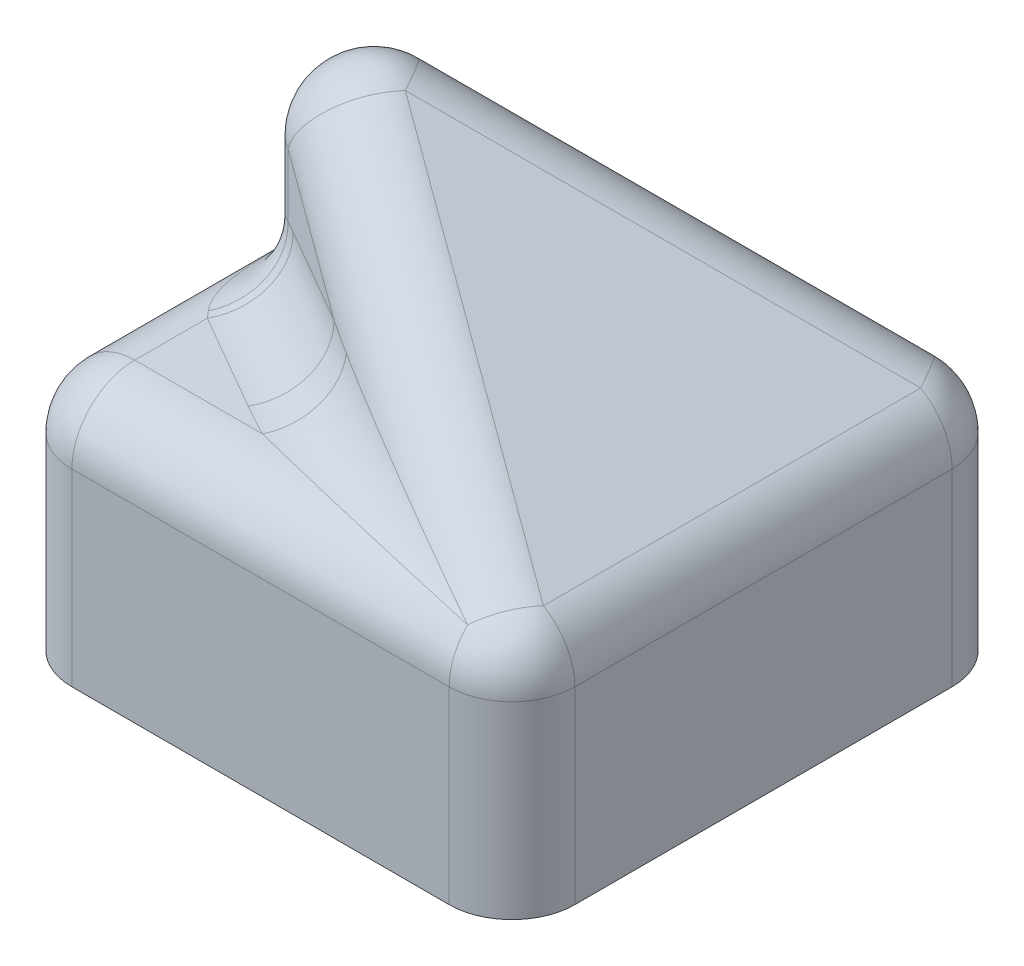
SolidWorks part; units mm, degrees
ref_plane "Front" through (0, 0, 0) normal (0, 0, 1) x (1, 0, 0)
ref_plane "Top" through (0, 0, 0) normal (0, 1, 0) x (1, 0, 0)
ref_plane "Right" through (0, 0, 0) normal (1, 0, 0) x (0, 0, -1)
sketch "Sketch1" plane through (0, 0, 0) normal (0, 1, 0) x (1, 0, 0)
  line L0 (-25.4, -25.4) -> (25.4, 25.4) construction
  line L1 (-19.05, -25.4) -> (19.05, -25.4)
  line L2 (-25.4, -19.05) -> (-25.4, 19.05)
  line L3 (-19.05, 25.4) -> (19.05, 25.4)
  line L4 (25.4, -19.05) -> (25.4, 19.05)
  arc A0 (-25.4, 19.05) -> (-19.05, 25.4) centre (-19.05, 19.05) cw
  arc A1 (-19.05, -25.4) -> (-25.4, -19.05) centre (-19.05, -19.05) cw
  arc A2 (19.05, -25.4) -> (25.4, -19.05) centre (19.05, -19.05) ccw
  arc A3 (19.05, 25.4) -> (25.4, 19.05) centre (19.05, 19.05) cw
  point P11 (25.4, -25.4)
  dimension "D2" = 6.35
  dimension "D1" = 50.8
extrude "Bottom Piece" add sketch "Sketch1" along normal blind 25.4
fillet "Fillet14" radius 6.35 8 edges at (0, 25.4, -25.4) (23.5401, 25.4, -23.5401) (25.4, 25.4, 0) (23.5401, 25.4, 23.5401) (0, 25.4, 25.4) (-23.5401, 25.4, 23.5401) (-25.4, 25.4, 0) (-23.5401, 25.4, -23.5401)
sketch "Sketch3" plane through (0, 0, 0) normal (0, 0, 1) x (1, 0, 0)
  line L0 (-11.624, 44.092) -> (22.225, 24.5493)
  line L5 (-19.05, 25.4) -> (19.05, 25.4) construction
  arc A0 (25.4, 19.05) -> (19.05, 25.4) centre (19.05, 19.05) ccw construction
  dimension "D2" = 30
ref_plane "Angled Plane" through (22.225, 24.5493, 0) normal (0.5, 0.866, 0) x (-0.866, 0.5, 0)
sketch "Sketch2" plane through (0, 0, 0) normal (0, 1, 0) x (1, 0, 0)
  line L0 (25.4, 19.05) -> (25.4, -19.05)
  line L1 (15.875, -24.5493) -> (-17.1206, -5.4993)
  line L2 (-17.1206, 5.4993) -> (15.875, 24.5493)
  arc A0 (25.4, -19.05) -> (15.875, -24.5493) centre (19.05, -19.05) cw
  arc A1 (-17.1206, -5.4993) -> (-17.1206, 5.4993) centre (-13.9456, 0) cw
  arc A2 (25.4, 19.05) -> (15.875, 24.5493) centre (19.05, 19.05) ccw
  arc A3 (19.05, -25.4) -> (25.4, -19.05) centre (19.05, -19.05) ccw construction
  point P3 (25.4, 0)
  point P7 (25.4, -30.0485)
  point P12 (25.4, 30.0485)
  dimension "D3" = 6.35
extrude "Angled Piece" add sketch "Sketch2" along normal up to surface (22.7162 mm away) separate body
fillet "Fillet39" radius 6.35 6 edges at (-20.2956, 49.0985, 0) (-0.6228, 37.7404, -15.0243) (22.225, 24.5493, -24.5493) (25.4, 22.7162, 0) (22.225, 24.5493, 24.5493) (-0.6228, 37.7404, 15.0243)
combine bodies "Combine1" operation type add bodies to combine 107 101
fillet "Fillet40" radius 6.35 9 edges at (12.2316, 24.9166, 21.48) (5.6591, 25.4, 18.6365) (12.2316, 24.9166, -21.48) (5.6591, 25.4, -18.6365) (-6.122, 25.4, -11.8493) (-18.1739, 25.4, -4.7375) (-20.2323, 25.289, -0.8944) (-18.1739, 25.4, 4.7375) (-6.122, 25.4, 11.8493)
